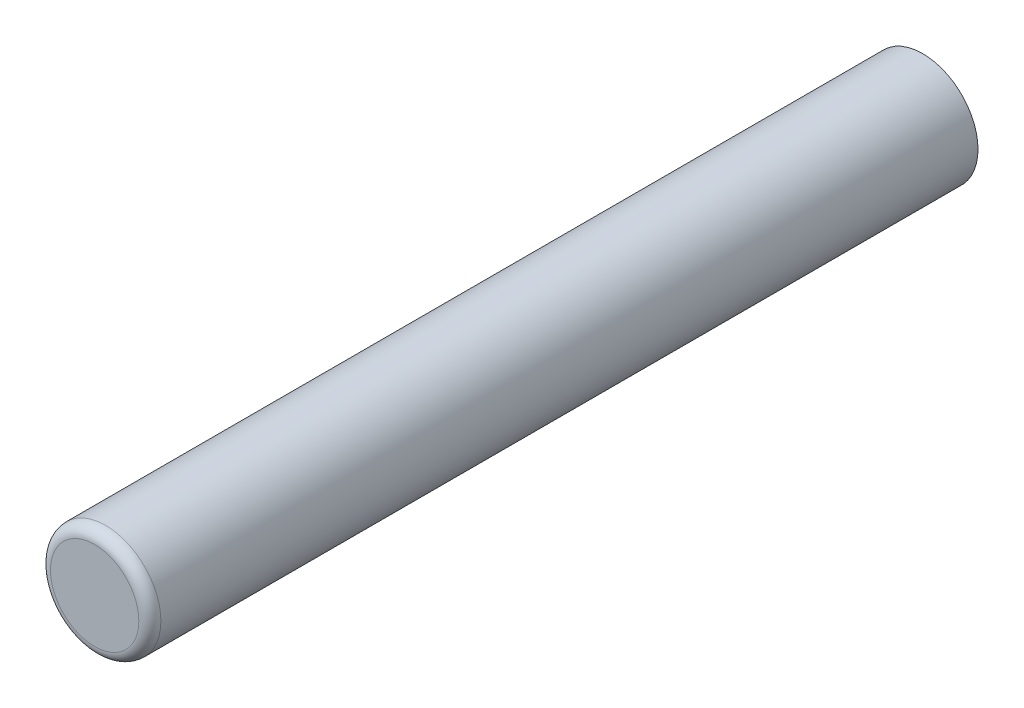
SolidWorks part; units mm, degrees
ref_plane "Front" through (0, 0, 0) normal (0, 0, 1) x (1, 0, 0)
ref_plane "Top" through (0, 0, 0) normal (0, 1, 0) x (1, 0, 0)
ref_plane "Right" through (0, 0, 0) normal (1, 0, 0) x (0, 0, -1)
sketch "Sketch1" plane through (0, 0, 0) normal (0, 0, 1) x (1, 0, 0)
  circle A0 centre (0, 0) radius 0.508
extrude "Extrude1" add sketch "Sketch1" along normal blind 7.62
fillet "Fillet1" radius 0.1016 1 edges at (0.508, 0, 7.62)
